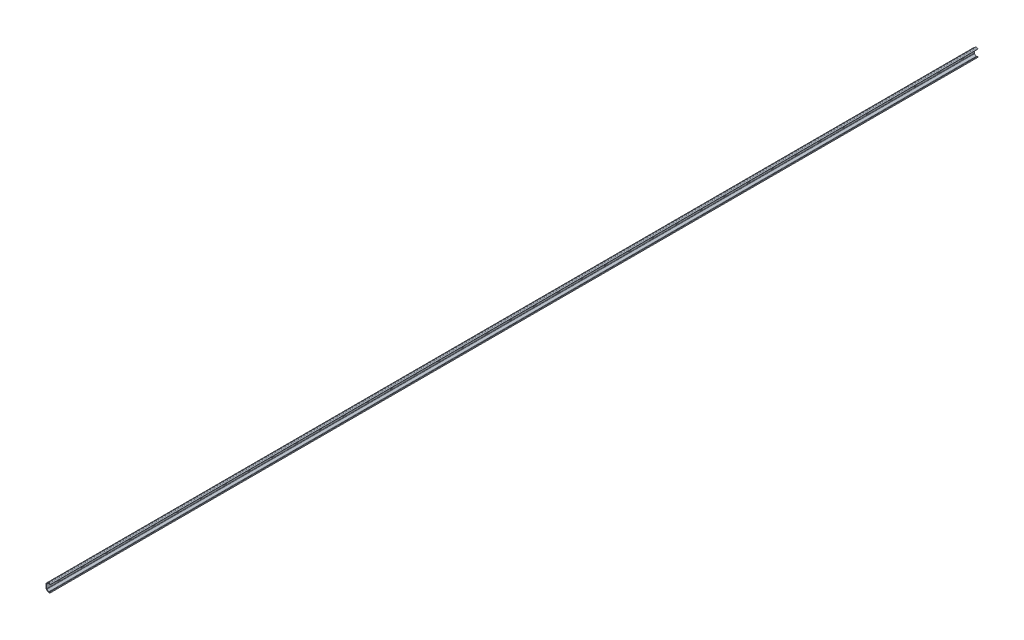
SolidWorks part; units mm, degrees
ref_plane "Front Plane" through (0, 0, 0) normal (0, 0, 1) x (1, 0, 0)
ref_plane "Top Plane" through (0, 0, 0) normal (0, 1, 0) x (1, 0, 0)
ref_plane "Right Plane" through (0, 0, 0) normal (1, 0, 0) x (0, 0, -1)
sketch "Sketch1" plane through (0, 0, 0) normal (0, 0, 1) x (1, 0, 0)
  line L0 (13.5661, -10.1611) -> (15, -12.209)
  line L1 (15, -12.209) -> (12.159, -14.1983)
  line L2 (7.841, -14.1983) -> (2.0723, -10.159)
  line L3 (0, -6.37) -> (0, 6.37)
  line L4 (2.0723, 10.159) -> (7.841, 14.1983)
  line L5 (12.159, 14.1983) -> (15, 12.209)
  line L6 (15, 12.209) -> (13.5661, 10.1611)
  line L7 (13.5661, 10.1611) -> (10.861, 12.0552)
  line L8 (9.139, 12.0552) -> (3.2542, 7.9346)
  line L9 (2.5, 6.37) -> (2.5, -6.37)
  line L10 (3.2542, -7.9346) -> (9.139, -12.0552)
  line L11 (10.861, -12.0552) -> (13.5661, -10.1611)
  arc A0 (12.159, -14.1983) -> (7.841, -14.1983) centre (10, -11.1149) cw
  arc A1 (2.0723, -10.159) -> (0, -6.37) centre (4.8653, -6.1702) cw
  arc A2 (0, 6.37) -> (2.0723, 10.159) centre (4.5, 6.37) cw
  arc A3 (7.841, 14.1983) -> (12.159, 14.1983) centre (10, 11.1149) cw
  arc A4 (10.861, 12.0552) -> (9.139, 12.0552) centre (10, 10.8255) ccw
  arc A5 (3.2542, 7.9346) -> (2.5, 6.37) centre (4.2732, 6.4793) ccw
  arc A6 (2.5, -6.37) -> (3.2542, -7.9346) centre (4.5, -6.37) ccw
  arc A7 (9.139, -12.0552) -> (10.861, -12.0552) centre (10, -10.8255) ccw
  dimension "D1" = 3.7641
  dimension "D2" = 4.8694
  dimension "D3" = 4.5
  dimension "D4" = 3.7641
  dimension "D5" = 1.5011
  dimension "D6" = 1.7766
  dimension "D7" = 2
  dimension "D8" = 1.5011
  dimension "D9" = 2.0723
  dimension "D10" = 2.0723
  dimension "D11" = 2.5
  dimension "D12" = 3.2542
  dimension "D13" = 3.2542
  dimension "D14" = 4.2732
  dimension "D15" = 4.8653
  dimension "D16" = 7.841
  dimension "D17" = 7.841
  dimension "D18" = 4.5
  dimension "D19" = 9.139
  dimension "D20" = 10
  dimension "D21" = 10.861
  dimension "D22" = 6.37
  dimension "D23" = 9.139
  dimension "D24" = 6.1702
  dimension "D27" = 10.861
  dimension "D31" = 13.5661
  dimension "D32" = 13.5661
  dimension "D33" = 15
  dimension "D34" = 15
extrude "Extrude1" add sketch "Sketch1" against normal blind 3120
sketch "Sketch3" plane through (2.5, 0, 0) normal (1, 0, 0) x (0, 0, -1)
  line L0 (37.5, 0) -> (42.5, 0) construction
  line L1 (37.5, 3) -> (42.5, 3)
  line L2 (37.5, -3) -> (42.5, -3)
  arc A0 (37.5, 3) -> (37.5, -3) centre (37.5, 0) ccw
  arc A1 (42.5, 3) -> (42.5, -3) centre (42.5, 0) cw
  point P5 (40, 0)
  dimension "D1" = 5
  dimension "D2" = 6
  dimension "D3" = 40
extrude "Extrude2" cut sketch "Sketch3" against normal through all
pattern_linear "LPattern1" count 39 spacing 80 along (0, 0, -1) of "Extrude2"
